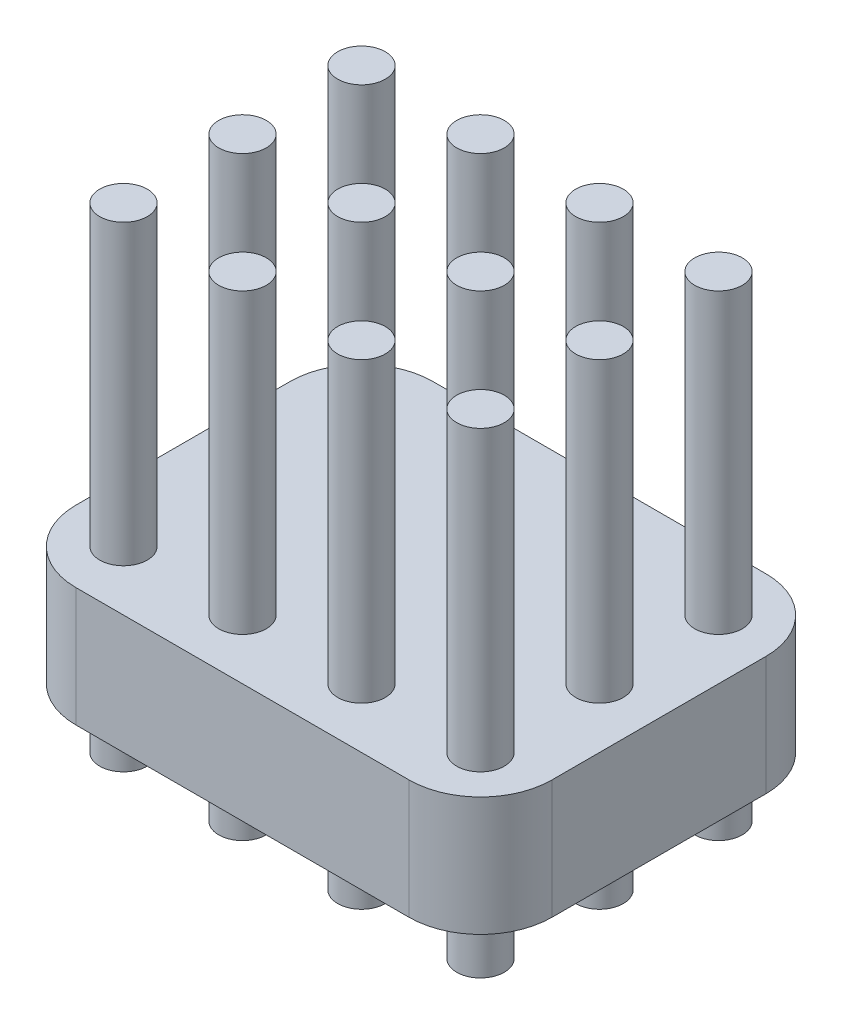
SolidWorks part; units mm, degrees
ref_plane "Ebene vorne" through (0, 0, 0) normal (0, 0, 1) x (1, 0, 0)
ref_plane "Ebene oben" through (0, 0, 0) normal (0, 1, 0) x (1, 0, 0)
ref_plane "Ebene rechts" through (0, 0, 0) normal (1, 0, 0) x (0, 0, -1)
sketch "Skizze1" plane through (0, 0, 0) normal (0, 1, 0) x (1, 0, 0)
  line L1 (10, 7.5) -> (-10, 7.5)
  line L2 (10, 7.5) -> (10, -7.5)
  line L3 (10, -7.5) -> (-10, -7.5)
  line L4 (-10, 7.5) -> (-10, -7.5)
  line L5 (10, 7.5) -> (-10, -7.5) construction
  line L6 (10, -7.5) -> (-10, 7.5) construction
  point P0 (0, 0)
  dimension "D1" = 20
  dimension "D2" = 15
extrude "Aufsatz-Linear austragen1" add sketch "Skizze1" along normal mid plane 5
sketch "Skizze2" plane through (0, 0, 0) normal (0, 1, 0) x (1, 0, 0)
  line L0 (-10, 7.5) -> (-10, -7.5) construction
  line L1 (10, 7.5) -> (-10, 7.5) construction
  circle A0 centre (-7.5, 5) radius 1
  dimension "D1" = 2
  dimension "D2" = 2.5
  dimension "D3" = 2.5
extrude "Aufsatz-Linear austragen2" add sketch "Skizze2" along normal blind 15 and the other way blind 5 separate body
pattern_linear "Lineares Muster1" count 4 spacing 5 along (1, 0, 0) count 3 spacing 5 along (0, 0, 1) of "Aufsatz-Linear austragen2"
fillet "Verrundung1" radius 3 4 edges at (10, 0, 7.5) (10, 0, -7.5) (-10, 0, 7.5) (-10, 0, -7.5)
